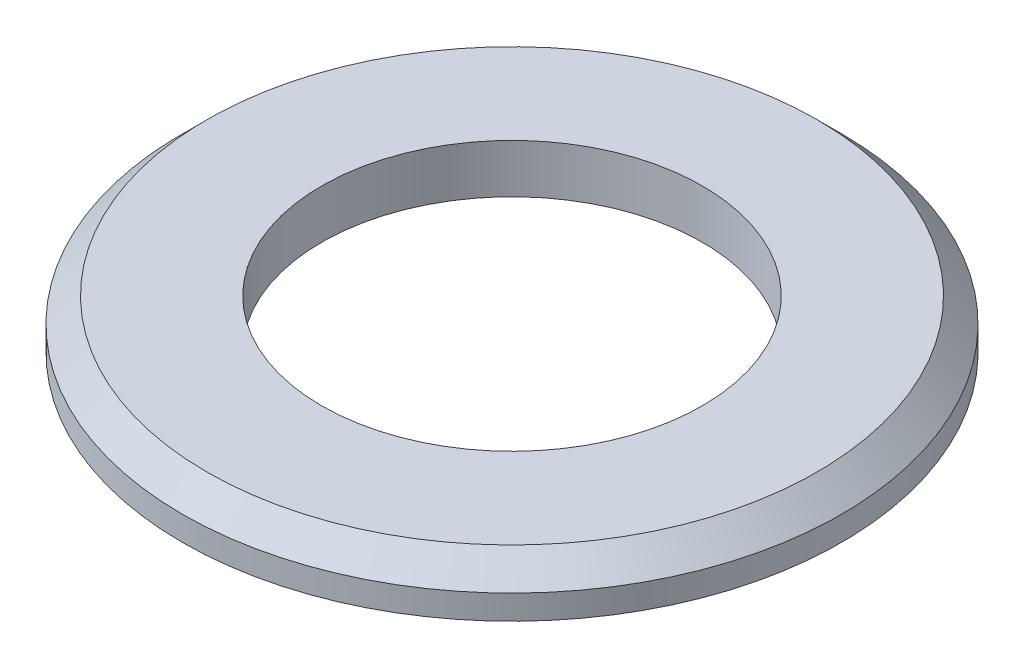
SolidWorks part; units mm, degrees
ref_plane "Front" through (0, 0, 0) normal (0, 0, 1) x (1, 0, 0)
ref_plane "Top" through (0, 0, 0) normal (0, 1, 0) x (1, 0, 0)
ref_plane "Right" through (0, 0, 0) normal (1, 0, 0) x (0, 0, -1)
sketch "Sketch1" plane through (0, 0, 0) normal (0, 1, 0) x (1, 0, 0)
  circle A0 centre (0, 0) radius 39
  circle A1 centre (0, 0) radius 67.5
extrude "Extrude1" add sketch "Sketch1" along normal blind 10
chamfer "Chamfer1" distance 5 1 edges at (0, 10, 67.5)
